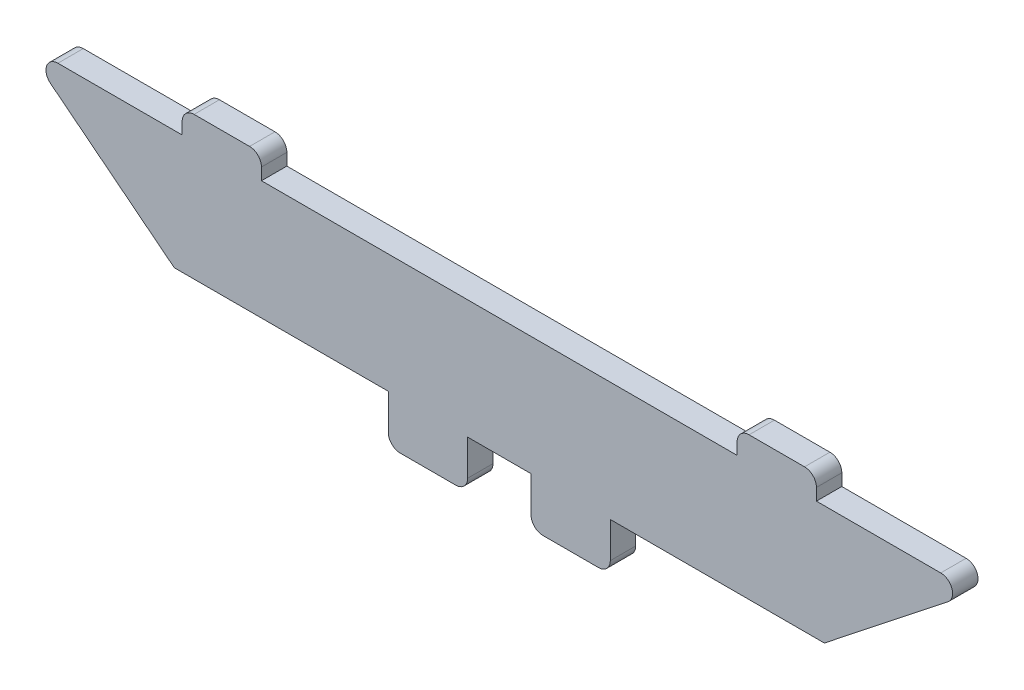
SolidWorks part; units mm, degrees
ref_plane "Plan de face" through (0, 0, 0) normal (0, 0, 1) x (1, 0, 0)
ref_plane "Plan de dessus" through (0, 0, 0) normal (0, 1, 0) x (1, 0, 0)
ref_plane "Plan de droite" through (0, 0, 0) normal (1, 0, 0) x (0, 0, -1)
sketch "Esquisse1" plane through (0, 0, 0) normal (0, 0, 1) x (1, 0, 0)
  line L0 (-41, 0) -> (-14, 0)
  line L1 (-14, 0) -> (-14, -6)
  line L2 (-14, -6) -> (-4, -6)
  line L3 (-4, -6) -> (-4, 0)
  line L4 (-4, 0) -> (4, 0)
  line L5 (-41, 0) -> (-60, 15)
  line L6 (-60, 15) -> (-40, 15)
  line L7 (-40, 15) -> (-40, 18)
  line L8 (-40, 18) -> (-30, 18)
  line L9 (-30, 18) -> (-30, 15)
  line L10 (-30, 15) -> (30, 15)
  line L11 (0, 15) -> (0, 0) construction
  line L12 (30, 18) -> (30, 15)
  line L13 (40, 18) -> (30, 18)
  line L14 (4, -6) -> (4, 0)
  line L15 (14, -6) -> (4, -6)
  line L16 (14, 0) -> (14, -6)
  line L17 (41, 0) -> (14, 0)
  line L18 (40, 15) -> (40, 18)
  line L19 (60, 15) -> (40, 15)
  line L20 (41, 0) -> (60, 15)
  dimension "D1" = 6
  dimension "D2" = 3
  dimension "D3" = 10
  dimension "D4" = 15
  dimension "D5" = 4
  dimension "D6" = 27
  dimension "D7" = 20
  dimension "D8" = 30
  dimension "D9" = 10
extrude "Boss.-Extru.1" add sketch "Esquisse1" along normal blind 3.2
fillet "Congé1" radius 1.5 8 edges at (-40, 18, 1.6) (-30, 18, 1.6) (30, 18, 1.6) (40, 18, 1.6) (14, -6, 1.6) (4, -6, 1.6) (-4, -6, 1.6) (-14, -6, 1.6)
fillet "Congé2" radius 1.5 2 edges at (-60, 15, 1.6) (60, 15, 1.6)
